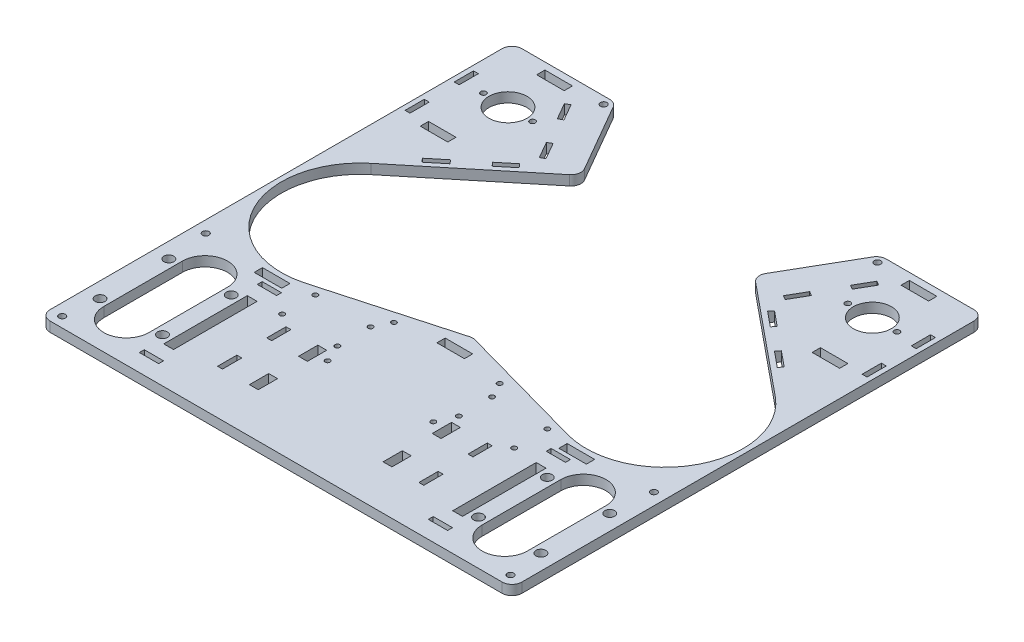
SolidWorks part; units mm, degrees
ref_plane "Front" through (0, 0, 0) normal (0, 0, 1) x (1, 0, 0)
ref_plane "Top" through (0, 0, 0) normal (0, 1, 0) x (1, 0, 0)
ref_plane "Right" through (0, 0, 0) normal (1, 0, 0) x (0, 0, -1)
sketch "Sketch1" plane through (0, 0, 0) normal (0, 1, 0) x (1, 0, 0)
  line L0 (-146.05, 0) -> (146.05, 0)
  line L1 (-152.4, 6.35) -> (-152.4, 298.45)
  line L2 (-136.8425, 76.2996) -> (-136.8425, 25.4996)
  line L3 (-107.6325, 76.2996) -> (-107.6325, 25.4996)
  line L4 (-58.5756, 257.8194) -> (-83.8668, 301.625)
  line L5 (-60.0496, 249.7331) -> (-130.6265, 191.8892)
  line L6 (-98.425, 101.7992) -> (-98.425, 0) construction
  line L7 (-66.6125, 72.9976) -> (-63.4375, 72.9976)
  line L8 (-66.6125, 72.9976) -> (-66.6125, 60.5516)
  line L9 (-66.6125, 60.5516) -> (-63.4375, 60.5516)
  line L10 (-63.4375, 72.9976) -> (-63.4375, 60.5516)
  line L11 (-46.0375, 72.9976) -> (-40.3225, 72.9976)
  line L12 (-46.0375, 72.9976) -> (-46.0375, 60.5516)
  line L13 (-46.0375, 60.5516) -> (-40.3225, 60.5516)
  line L14 (-122.2375, 90.9046) -> (-122.2375, 10.8946) construction
  line L15 (-40.3225, 72.9976) -> (-40.3225, 60.5516)
  line L16 (-1098.425, 50.8996) -> (48901.575, 50.8996) construction
  line L17 (-40.3225, 28.8016) -> (-40.3225, 41.2476)
  line L18 (-46.0375, 41.2476) -> (-40.3225, 41.2476)
  line L19 (1.7012, 126.7679) -> (84.8154, 103.6562)
  line L20 (-146.05, 304.8) -> (-89.366, 304.8)
  line L21 (0, -1000) -> (0, 49000) construction
  line L22 (-1.7012, 126.7679) -> (-84.8154, 103.6562)
  line L23 (-139.1393, 267.5109) -> (-96.2768, 267.5109) construction
  line L24 (-98.425, 152.5992) -> (98.425, 152.5992) construction
  line L25 (-98.425, 152.5992) -> (0, 177.8) construction
  line L26 (0, 177.8) -> (98.425, 152.5992) construction
  line L27 (146.05, 304.8) -> (89.366, 304.8)
  line L28 (60.0496, 249.7331) -> (130.6265, 191.8892)
  line L29 (58.5756, 257.8194) -> (83.8668, 301.625)
  line L30 (152.4, 6.35) -> (152.4, 298.45)
  line L31 (-46.0375, 28.8016) -> (-46.0375, 41.2476)
  line L32 (90.17, 77.8871) -> (90.17, 23.9121)
  line L33 (-96.52, 77.8871) -> (-90.17, 77.8871)
  line L34 (-96.52, 77.8871) -> (-96.52, 23.9121)
  line L35 (-96.52, 23.9121) -> (-90.17, 23.9121)
  line L36 (-90.17, 77.8871) -> (-90.17, 23.9121)
  line L37 (96.52, 23.9121) -> (90.17, 23.9121)
  line L38 (96.52, 77.8871) -> (96.52, 23.9121)
  line L39 (96.52, 77.8871) -> (90.17, 77.8871)
  line L40 (-149.225, 276.7424) -> (-146.05, 276.7424)
  line L41 (-149.225, 276.7424) -> (-149.225, 264.2964)
  line L42 (-149.225, 264.2964) -> (-146.05, 264.2964)
  line L43 (-146.05, 276.7424) -> (-146.05, 264.2964)
  line L44 (107.6325, 76.2996) -> (107.6325, 25.4996)
  line L45 (136.8425, 76.2996) -> (136.8425, 25.4996)
  line L46 (-117.708, 304.8) -> (-117.708, 202.477) construction
  line L47 (108.818, 300.2742) -> (108.818, 294.9402)
  line L48 (126.598, 294.9402) -> (108.818, 294.9402)
  line L49 (126.598, 300.2742) -> (126.598, 294.9402)
  line L50 (126.598, 300.2742) -> (108.818, 300.2742)
  line L51 (-46.0375, 28.8016) -> (-40.3225, 28.8016)
  line L52 (-63.4375, 28.8016) -> (-63.4375, 41.2476)
  line L53 (-66.6125, 41.2476) -> (-63.4375, 41.2476)
  line L54 (-66.6125, 28.8016) -> (-66.6125, 41.2476)
  line L55 (-66.6125, 28.8016) -> (-63.4375, 28.8016)
  line L56 (66.6125, 28.8016) -> (63.4375, 28.8016)
  line L57 (-146.05, 232.5464) -> (-146.05, 244.9924)
  line L58 (-149.225, 244.9924) -> (-146.05, 244.9924)
  line L59 (-149.225, 232.5464) -> (-149.225, 244.9924)
  line L60 (-149.225, 232.5464) -> (-146.05, 232.5464)
  line L61 (66.6125, 28.8016) -> (66.6125, 41.2476)
  line L62 (66.6125, 41.2476) -> (63.4375, 41.2476)
  line L63 (63.4375, 28.8016) -> (63.4375, 41.2476)
  line L64 (46.0375, 28.8016) -> (40.3225, 28.8016)
  line L65 (46.0375, 28.8016) -> (46.0375, 41.2476)
  line L66 (46.0375, 41.2476) -> (40.3225, 41.2476)
  line L67 (40.3225, 28.8016) -> (40.3225, 41.2476)
  line L68 (40.3225, 72.9976) -> (40.3225, 60.5516)
  line L69 (46.0375, 60.5516) -> (40.3225, 60.5516)
  line L70 (46.0375, 72.9976) -> (46.0375, 60.5516)
  line L71 (46.0375, 72.9976) -> (40.3225, 72.9976)
  line L72 (63.4375, 72.9976) -> (63.4375, 60.5516)
  line L73 (-126.598, 300.2742) -> (-108.818, 300.2742)
  line L74 (-126.598, 300.2742) -> (-126.598, 294.9402)
  line L75 (-126.598, 294.9402) -> (-108.818, 294.9402)
  line L76 (-108.818, 300.2742) -> (-108.818, 294.9402)
  line L77 (66.6125, 60.5516) -> (63.4375, 60.5516)
  line L78 (66.6125, 72.9976) -> (66.6125, 60.5516)
  line L79 (66.6125, 72.9976) -> (63.4375, 72.9976)
  line L80 (-101.5176, 287.7471) -> (-98.768, 289.3346)
  line L81 (-101.5176, 287.7471) -> (-95.2946, 276.9686)
  line L82 (-95.2946, 276.9686) -> (-92.545, 278.5561)
  line L83 (-98.768, 289.3346) -> (-92.545, 278.5561)
  line L84 (-76.67, 251.0597) -> (-82.893, 261.8383)
  line L85 (-85.6426, 260.2508) -> (-82.893, 261.8383)
  line L86 (-79.4196, 249.4722) -> (-85.6426, 260.2508)
  line L87 (-79.4196, 249.4722) -> (-76.67, 251.0597)
  line L88 (-71.2212, 279.7222) -> (43230.049, 25279.7222) construction
  line L89 (-95.3381, 220.8111) -> (31599.0975, -38450.4024) construction
  line L90 (-82.2722, 239.7301) -> (-80.2596, 237.2744)
  line L91 (-82.2722, 239.7301) -> (-91.8982, 231.8407)
  line L92 (-91.8982, 231.8407) -> (-89.8856, 229.3851)
  line L93 (-80.2596, 237.2744) -> (-89.8856, 229.3851)
  line L94 (-93.9198, 277.7623) -> (-84.2678, 261.0446) construction
  line L95 (-147.6375, 264.2964) -> (-147.6375, 244.9924) construction
  line L96 (-65.025, 60.5516) -> (-65.025, 41.2476) construction
  line L97 (-114.8347, 208.9371) -> (-104.8158, 217.1485)
  line L98 (-106.8284, 219.6041) -> (-104.8158, 217.1485)
  line L99 (-116.8473, 211.3927) -> (-106.8284, 219.6041)
  line L100 (-116.8473, 211.3927) -> (-114.8347, 208.9371)
  line L101 (-90.8919, 230.6129) -> (-105.8221, 218.3763) construction
  line L102 (-64.0748, 254.6444) -> (-50064.0748, 254.6444) construction
  line L103 (-149.225, 270.5194) -> (-152.4, 270.5194) construction
  line L104 (-95.6565, 283.9453) -> (-79.1587, 293.4703) construction
  line L105 (-85.0726, 233.3297) -> (-83.06, 230.8741) construction
  line L106 (91.8982, 231.8407) -> (89.8856, 229.3851)
  line L107 (82.2722, 239.7301) -> (91.8982, 231.8407)
  line L108 (80.2596, 237.2744) -> (89.8856, 229.3851)
  line L109 (82.2722, 239.7301) -> (80.2596, 237.2744)
  line L110 (116.8473, 211.3927) -> (114.8347, 208.9371)
  line L111 (116.8473, 211.3927) -> (106.8284, 219.6041)
  line L112 (106.8284, 219.6041) -> (104.8158, 217.1485)
  line L113 (114.8347, 208.9371) -> (104.8158, 217.1485)
  line L114 (79.4196, 249.4722) -> (76.67, 251.0597)
  line L115 (79.4196, 249.4722) -> (85.6426, 260.2508)
  line L116 (85.6426, 260.2508) -> (82.893, 261.8383)
  line L117 (76.67, 251.0597) -> (82.893, 261.8383)
  line L118 (98.768, 289.3346) -> (92.545, 278.5561)
  line L119 (95.2946, 276.9686) -> (92.545, 278.5561)
  line L120 (101.5176, 287.7471) -> (95.2946, 276.9686)
  line L121 (101.5176, 287.7471) -> (98.768, 289.3346)
  line L122 (149.225, 232.5464) -> (146.05, 232.5464)
  line L123 (149.225, 232.5464) -> (149.225, 244.9924)
  line L124 (149.225, 244.9924) -> (146.05, 244.9924)
  line L125 (146.05, 232.5464) -> (146.05, 244.9924)
  line L126 (146.05, 276.7424) -> (146.05, 264.2964)
  line L127 (149.225, 264.2964) -> (146.05, 264.2964)
  line L128 (149.225, 276.7424) -> (149.225, 264.2964)
  line L129 (149.225, 276.7424) -> (146.05, 276.7424)
  line L130 (-93.345, 77.8871) -> (-93.345, 87.4121) construction
  line L131 (-99.568, 90.5871) -> (-87.122, 90.5871)
  line L132 (-99.568, 90.5871) -> (-99.568, 87.4121)
  line L133 (-99.568, 87.4121) -> (-87.122, 87.4121)
  line L134 (-87.122, 90.5871) -> (-87.122, 87.4121)
  line L135 (-87.122, 11.2121) -> (-87.122, 14.3871)
  line L136 (-99.568, 14.3871) -> (-87.122, 14.3871)
  line L137 (-99.568, 11.2121) -> (-99.568, 14.3871)
  line L138 (-99.568, 11.2121) -> (-87.122, 11.2121)
  line L139 (99.568, 11.2121) -> (87.122, 11.2121)
  line L140 (99.568, 11.2121) -> (99.568, 14.3871)
  line L141 (99.568, 14.3871) -> (87.122, 14.3871)
  line L142 (87.122, 11.2121) -> (87.122, 14.3871)
  line L143 (87.122, 90.5871) -> (87.122, 87.4121)
  line L144 (99.568, 87.4121) -> (87.122, 87.4121)
  line L145 (99.568, 90.5871) -> (99.568, 87.4121)
  line L146 (99.568, 90.5871) -> (87.122, 90.5871)
  line L147 (-34.1313, 110.2721) -> (-34.1313, 67.4096) construction
  line L148 (-34.1313, 67.4096) -> (34.1313, 67.4096) construction
  line L149 (34.1313, 67.4096) -> (34.1313, 110.2721) construction
  line L150 (34.1313, 110.2721) -> (-34.1313, 110.2721) construction
  line L151 (-74.93, 100.2709) -> (-74.93, 78.8396) construction
  line L152 (-74.93, 78.8396) -> (-39.2112, 78.8396) construction
  line L153 (-39.2112, 78.8396) -> (-39.2112, 100.2709) construction
  line L154 (-39.2112, 100.2709) -> (-74.93, 100.2709) construction
  line L155 (-135.488, 233.934) -> (-117.708, 233.934)
  line L156 (-135.488, 233.934) -> (-135.488, 228.6)
  line L157 (-135.488, 228.6) -> (-117.708, 228.6)
  line L158 (-117.708, 233.934) -> (-117.708, 228.6)
  line L159 (-107.315, 98.4972) -> (-89.535, 98.4972)
  line L160 (-107.315, 98.4972) -> (-107.315, 93.1632)
  line L161 (-107.315, 93.1632) -> (-89.535, 93.1632)
  line L162 (-89.535, 98.4972) -> (-89.535, 93.1632)
  line L163 (-8.89, 118.11) -> (8.89, 118.11)
  line L164 (-8.89, 118.11) -> (-8.89, 112.776)
  line L165 (-8.89, 112.776) -> (8.89, 112.776)
  line L166 (8.89, 118.11) -> (8.89, 112.776)
  line L167 (-1000, 228.6) -> (49000, 228.6) construction
  line L168 (117.708, 233.934) -> (117.708, 228.6)
  line L169 (135.488, 228.6) -> (117.708, 228.6)
  line L170 (135.488, 233.934) -> (135.488, 228.6)
  line L171 (135.488, 233.934) -> (117.708, 233.934)
  line L172 (89.535, 98.4972) -> (89.535, 93.1632)
  line L173 (107.315, 93.1632) -> (89.535, 93.1632)
  line L174 (107.315, 98.4972) -> (107.315, 93.1632)
  line L175 (107.315, 98.4972) -> (89.535, 98.4972)
  line L176 (-84.1852, 297.0544) -> (8381.8698, 43051.89) construction
  line L177 (-83.7777, 299.1124) -> (-0.3084, 282.5843) construction
  line L178 (-83.4693, 300.6697) -> (0, 284.1416) construction
  line L179 (-84.0861, 297.5552) -> (-0.6167, 281.0271) construction
  line L180 (0, 284.1416) -> (-0.6167, 281.0271) construction
  circle A0 centre (-98.425, 152.5992) radius 50.8 construction
  arc A1 (-136.8425, 76.2996) -> (-107.6325, 76.2996) centre (-122.2375, 76.2996) cw
  arc A2 (-136.8425, 25.4996) -> (-107.6325, 25.4996) centre (-122.2375, 25.4996) ccw
  circle A3 centre (0, 177.8) radius 50.8 construction
  circle A4 centre (98.425, 152.5992) radius 50.8 construction
  circle A5 centre (-117.708, 267.5109) radius 21.4312 construction
  arc A6 (-130.6265, 191.8892) -> (-84.8154, 103.6562) centre (-98.425, 152.5992) ccw
  circle A7 centre (-133.583, 267.5109) radius 1.7859
  circle A8 centre (-101.833, 267.5109) radius 1.7859
  arc A9 (-146.05, 0) -> (-152.4, 6.35) centre (-146.05, 6.35) cw
  arc A10 (-58.5756, 257.8194) -> (-60.0496, 249.7331) centre (-64.0748, 254.6444) cw
  circle A11 centre (-117.708, 267.5109) radius 12.3031
  arc A12 (-152.4, 298.45) -> (-146.05, 304.8) centre (-146.05, 298.45) cw
  circle A13 centre (-142.3987, 73.1246) radius 3.175
  circle A14 centre (-102.0762, 28.6746) radius 3.175
  circle A15 centre (-142.3987, 28.6746) radius 3.175
  circle A16 centre (-102.0762, 73.1246) radius 3.175
  arc A17 (-89.366, 304.8) -> (-83.8668, 301.625) centre (-89.366, 298.45) cw
  arc A18 (89.366, 304.8) -> (83.8668, 301.625) centre (89.366, 298.45) ccw
  arc A19 (152.4, 298.45) -> (146.05, 304.8) centre (146.05, 298.45) ccw
  arc A20 (58.5756, 257.8194) -> (60.0496, 249.7331) centre (64.0748, 254.6444) ccw
  arc A21 (146.05, 0) -> (152.4, 6.35) centre (146.05, 6.35) ccw
  arc A22 (130.6265, 191.8892) -> (84.8154, 103.6562) centre (98.425, 152.5992) cw
  circle A23 centre (102.0762, 73.1246) radius 3.175
  circle A24 centre (142.3987, 28.6746) radius 3.175
  arc A25 (-1.7012, 126.7679) -> (1.7012, 126.7679) centre (0, 120.65) cw
  circle A26 centre (102.0762, 28.6746) radius 3.175
  circle A27 centre (142.3987, 73.1246) radius 3.175
  arc A28 (136.8425, 25.4996) -> (107.6325, 25.4996) centre (122.2375, 25.4996) cw
  arc A29 (136.8425, 76.2996) -> (107.6325, 76.2996) centre (122.2375, 76.2996) ccw
  circle A30 centre (117.708, 267.5109) radius 12.3031
  circle A31 centre (101.833, 267.5109) radius 1.7859
  circle A32 centre (133.583, 267.5109) radius 1.7859
  circle A33 centre (-144.78, 99.314) radius 2.0955
  circle A34 centre (-144.78, 6.604) radius 2.0955
  circle A35 centre (144.78, 99.314) radius 2.0955
  circle A36 centre (144.78, 6.604) radius 2.0955
  circle A37 centre (-34.1313, 67.4096) radius 1.5875
  circle A38 centre (34.1313, 67.4096) radius 1.5875
  circle A39 centre (-34.1313, 110.2721) radius 1.5875
  circle A40 centre (34.1313, 110.2721) radius 1.5875
  circle A41 centre (-74.93, 78.8396) radius 1.5875
  circle A42 centre (-39.2112, 78.8396) radius 1.5875
  circle A43 centre (-74.93, 100.2709) radius 1.5875
  circle A44 centre (-39.2112, 100.2709) radius 1.5875
  circle A45 centre (74.93, 78.8396) radius 1.5875
  circle A46 centre (39.2112, 78.8396) radius 1.5875
  circle A47 centre (39.2112, 100.2709) radius 1.5875
  circle A48 centre (74.93, 100.2709) radius 1.5875
  circle A49 centre (-88.4495, 300.0375) radius 2.0955
  circle A50 centre (-88.4495, 300.0375) radius 4.7625 construction
  circle A51 centre (-144.78, 99.314) radius 4.7625 construction
  circle A52 centre (88.4495, 300.0375) radius 2.0955
  point P17 (-55.88, 253.1505)
  point P26 (-122.2375, 50.8996)
  point P31 (-152.4, 0)
  point P32 (0, 0)
  point P42 (0, 127)
  point P89 (-96.52, 50.8996)
  point P130 (-98.425, 50.8996)
  point P135 (-117.708, 300.2742)
  point P166 (-71.2212, 279.7222)
  point P169 (-95.3381, 220.8111)
  point P170 (-147.6375, 254.6444)
  point P176 (-89.0938, 269.4034)
  point P181 (-65.025, 50.8996)
  point P191 (-98.357, 224.4946)
  point P256 (0, 110.2721)
  point P291 (0, 118.11)
  point P292 (-98.425, 98.4972)
  point P297 (-57.0706, 100.2709)
  dimension "D8" = 3.175
  dimension "D9" = 42.8625
  dimension "D11" = 3.5719
  dimension "D12" = 31.75
  dimension "D13" = 24.6062
  dimension "D2" = 6.35
  dimension "D15" = 196.85
  dimension "D16" = 6.35
  dimension "D21" = 304.8
  dimension "D23" = 55.88
  dimension "D24" = 6.35
  dimension "D25" = 127
  dimension "D26" = 6.35
  dimension "D6" = 53.975
  dimension "D10" = 101.6
  dimension "D34" = 4.191
  dimension "D38" = 3.175
  dimension "D36" = 92.71
  dimension "D50" = 4.7625
  dimension "D51" = 9.525
  dimension "D3" = 17.4
  dimension "D4" = 5.5562
  dimension "D5" = 12.446
  dimension "D7" = 29.21
  dimension "D14" = 80.01
  dimension "D17" = 5.715
  dimension "D18" = 11.1125
  dimension "D19" = 5.334
  dimension "D20" = 17.78
  dimension "D22" = 30
  dimension "D27" = 22.225
  dimension "D28" = 19.304
  dimension "D29" = 40.3225
  dimension "D30" = 23.8125
  dimension "D31" = 6.35
  dimension "D32" = 53.975
  dimension "D33" = 3.175
  dimension "D35" = 7.62
  dimension "D37" = 36.5125
  dimension "D39" = 68.2625
  dimension "D40" = 42.8625
  dimension "D41" = 16.51
  dimension "D42" = 35.7188
  dimension "D43" = 21.4312
  dimension "D44" = 27.94
  dimension "D45" = 5.08
  dimension "D46" = 8.89
  dimension "D47" = 3.302
  dimension "D48" = 6.604
  dimension "D49" = 19.05
  dimension "D52" = 4.7625
  dimension "D53" = 56.684
  dimension "D54" = 85.09
  dimension "D55" = 50.5824
  dimension "D56" = 3.175
extrude "Extrude1" add sketch "Sketch1" along normal blind 6.35
